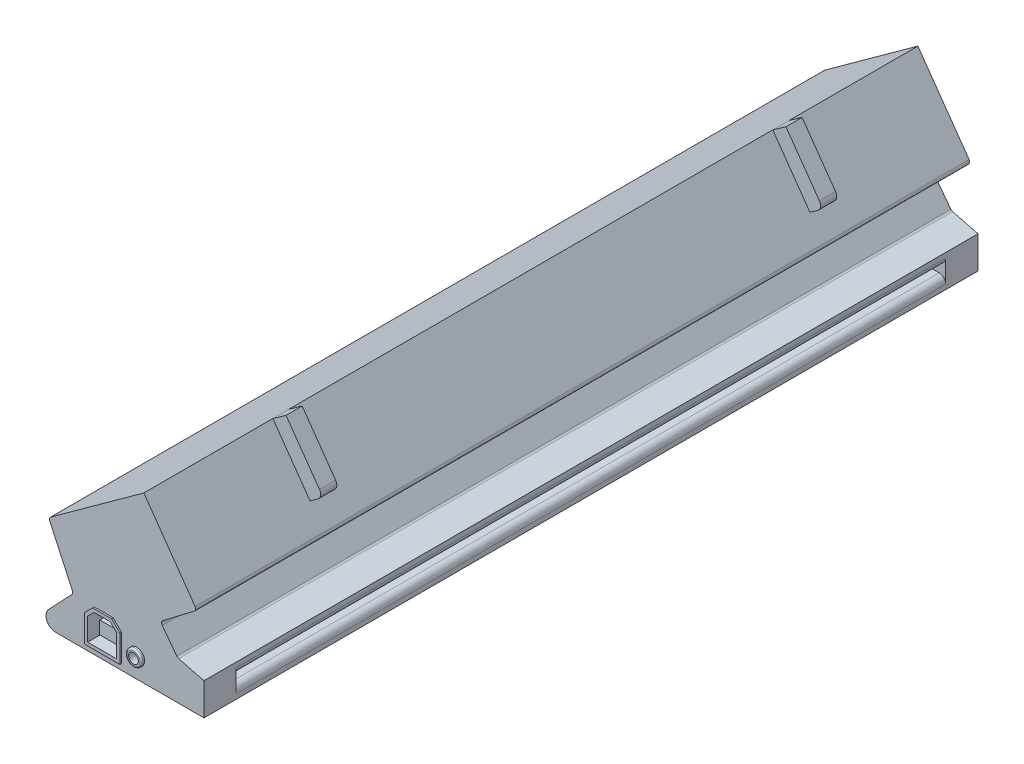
SolidWorks part; units mm, degrees
ref_plane "Piano frontale" through (0, 0, 0) normal (0, 0, 1) x (1, 0, 0)
ref_plane "Piano superiore" through (0, 0, 0) normal (0, 1, 0) x (1, 0, 0)
ref_plane "Piano destro" through (0, 0, 0) normal (1, 0, 0) x (0, 0, -1)
sketch "Schizzo1" plane through (0, 0, 0) normal (0, 0, 1) x (1, 0, 0)
  line L0 (-4.1561, 0) -> (41.8195, 0)
  line L1 (41.8195, 0) -> (41.8195, 10)
  line L2 (41.8195, 10) -> (33.6266, 12.1108)
  line L3 (33.6266, 12.1108) -> (28.2735, 19.1545)
  line L4 (28.2735, 19.1545) -> (39.6237, 27.7807)
  line L5 (39.6237, 27.7807) -> (23.1801, 51.092)
  line L6 (23.1801, 51.092) -> (-6.3381, 29.7152)
  line L7 (-6.3381, 29.7152) -> (1.3197, 13.1748)
  line L8 (1.3197, 13.1748) -> (-6.3381, 5.0588)
  arc A0 (-4.1561, 0) -> (-6.3381, 5.0588) centre (-4.1561, 3) cw
  dimension "D2" = 3
  dimension "D1" = 10
extrude "Estrusione-Estrusione1" add sketch "Schizzo1" along normal mid plane 240
sketch "Schizzo2" plane through (39.5438, 27.894, 0) normal (0.8172, 0.5764, 0) x (0, 0, -1)
  line L0 (-75, 28.3887) -> (-75, 18.3887)
  line L1 (-120, 28.3887) -> (120, 28.3887) construction
  line L2 (-75, 28.3887) -> (0, 28.3887) construction
  line L3 (75, 18.3887) -> (75, 28.3887)
  line L4 (75, 28.3887) -> (80, 28.3887)
  line L5 (80, 28.3887) -> (80, 8.3887)
  line L6 (80, 8.3887) -> (75, 8.3887)
  line L7 (-80, 8.3887) -> (-80, 28.3887)
  line L8 (-80, 28.3887) -> (-75, 28.3887)
  line L9 (0, 9.6441) -> (0, 4.6441) construction
  line L10 (0, 4.6441) -> (0, 0) construction
  line L11 (-75, 18.3887) -> (-75, 8.3887)
  line L12 (75, 18.3887) -> (75, 8.3887)
  line L13 (-75, 8.3887) -> (-80, 8.3887)
  line L14 (0, 28.3887) -> (75, 28.3887) construction
  line L15 (0, 28.3887) -> (0, 9.6441) construction
  dimension "D1" = 5
  dimension "D2" = 20
  dimension "D3" = 150
extrude "Estrusione-Estrusione2" add sketch "Schizzo2" along normal blind 5
sketch "Schizzo3" plane through (41.8195, 0, 0) normal (1, 0, 0) x (0, 0, -1)
  line L1 (-110, 6.5) -> (110, 6.5)
  line L2 (-110, 6.5) -> (-110, 3.5)
  line L3 (-110, 3.5) -> (110, 3.5)
  line L4 (110, 6.5) -> (110, 3.5)
  line L5 (-110, 6.5) -> (110, 3.5) construction
  line L6 (-110, 3.5) -> (110, 6.5) construction
  point P0 (0, 5)
  dimension "D1" = 3
  dimension "D2" = 220
  dimension "D3" = 5
extrude "Taglio-Estrusione1" cut sketch "Schizzo3" against normal blind 20
sketch "Schizzo4" plane through (39.5438, 27.894, 0) normal (0.8172, 0.5764, 0) x (0, 0, -1)
  line L0 (-120, 14.125) -> (-105.7363, 14.125) construction
  line L1 (-120, -0.1387) -> (-120, 28.3887) construction
  line L2 (-105.7363, 14.125) -> (-105.7363, 28.3887) construction
  line L3 (-120, 28.3887) -> (-80, 28.3887) construction
  line L4 (120, 14.125) -> (105.7363, 14.125) construction
  line L5 (120, -0.1387) -> (120, 28.3887) construction
  line L6 (105.7363, 14.125) -> (105.7363, 28.3887) construction
  line L7 (80, 28.3887) -> (120, 28.3887) construction
  circle A0 centre (-105.7363, 14.125) radius 9.9743
  circle A1 centre (105.7363, 14.125) radius 9.9855
sketch "Schizzo5" plane through (0, 0, 120) normal (0, 0, 1) x (1, 0, 0)
  line L0 (6.246, 2.8116) -> (15.246, 2.8116)
  line L1 (15.246, 2.8116) -> (15.246, 9.8116)
  line L2 (15.246, 9.8116) -> (13.246, 11.8116)
  line L3 (13.246, 11.8116) -> (8.246, 11.8116)
  line L4 (8.246, 11.8116) -> (6.246, 9.8116)
  line L5 (6.246, 9.8116) -> (6.246, 2.8116)
  line L7 (10.746, 11.8116) -> (10.746, 2.8116) construction
  dimension "D1" = 9
  dimension "D2" = 9
  dimension "D3" = 2
extrude "Taglio-Estrusione2" cut sketch "Schizzo5" against normal blind 15
sketch "Schizzo6" plane through (0, 0, 105) normal (0, 0, 1) x (1, 0, 0)
  line L0 (10.746, 2.8116) -> (10.746, 6.1527) construction
  line L1 (7.496, 4.1527) -> (13.996, 4.1527)
  line L2 (7.496, 4.1527) -> (7.496, 8.1527)
  line L3 (7.496, 8.1527) -> (13.996, 8.1527)
  line L4 (13.996, 4.1527) -> (13.996, 8.1527)
  line L5 (7.496, 4.1527) -> (13.996, 8.1527) construction
  line L6 (7.496, 8.1527) -> (13.996, 4.1527) construction
  line L7 (6.246, 2.8116) -> (15.246, 2.8116) construction
  point P0 (10.746, 6.1527)
  dimension "D1" = 4
  dimension "D2" = 6.5
extrude "Estrusione-Estrusione3" add sketch "Schizzo6" along normal blind 13
fillet "Raccordo1" radius 2 2 edges at (41.8195, 3.5, 0) (41.8195, 6.5, 0)
sketch "Schizzo7" plane through (0, 0, 120) normal (0, 0, 1) x (1, 0, 0)
  circle A0 centre (20.9662, 6.0942) radius 2.4718
  circle A1 centre (20.9662, 6.0942) radius 1.5117
extrude "Estrusione-Estrusione4" add sketch "Schizzo7" along normal blind 1
sketch "Schizzo8" plane through (0, 0, 120) normal (0, 0, 1) x (1, 0, 0)
  circle A0 centre (20.9662, 6.0942) radius 1.5117
extrude "Taglio-Estrusione3" cut sketch "Schizzo8" against normal blind 5
fillet "Raccordo2" radius 0.5 1 edges at (23.438, 6.0942, 121)
sketch "Schizzo9" plane through (0, 0, 120) normal (0, 0, 1) x (1, 0, 0)
  line L0 (6.246, 9.8116) -> (8.246, 11.8116)
  line L1 (8.246, 11.8116) -> (6.246, 9.8116) construction
  line L2 (8.246, 11.8116) -> (6.246, 9.8116) construction
  line L3 (8.246, 11.8116) -> (13.246, 11.8116)
  line L4 (13.246, 11.8116) -> (15.246, 9.8116)
  line L5 (15.246, 9.8116) -> (15.246, 2.8116)
  line L6 (15.246, 2.8116) -> (6.246, 2.8116)
  line L7 (6.246, 2.8116) -> (6.246, 9.8116)
  line L8 (5.246, 1.8116) -> (5.246, 10.2258)
  line L9 (5.246, 10.2258) -> (7.8318, 12.8116)
  line L10 (7.8318, 12.8116) -> (13.6603, 12.8116)
  line L11 (13.6603, 12.8116) -> (16.246, 10.2258)
  line L12 (16.246, 10.2258) -> (16.246, 1.8116)
  line L13 (16.246, 1.8116) -> (5.246, 1.8116)
  dimension "D1" = 1
extrude "Estrusione-Estrusione5" add sketch "Schizzo9" along normal blind 0.5
fillet "Raccordo3" radius 1 3 edges at (39.6237, 27.7807, 0) (33.6266, 12.1108, 0) (28.2735, 19.1545, 0)
fillet "Raccordo4" radius 1 2 edges at (1.3197, 13.1748, 0) (-6.3381, 29.7152, 0)
fillet "Raccordo5" radius 2 2 edges at (38.7942, 37.631, -77.5) (38.7942, 37.631, 77.5)
